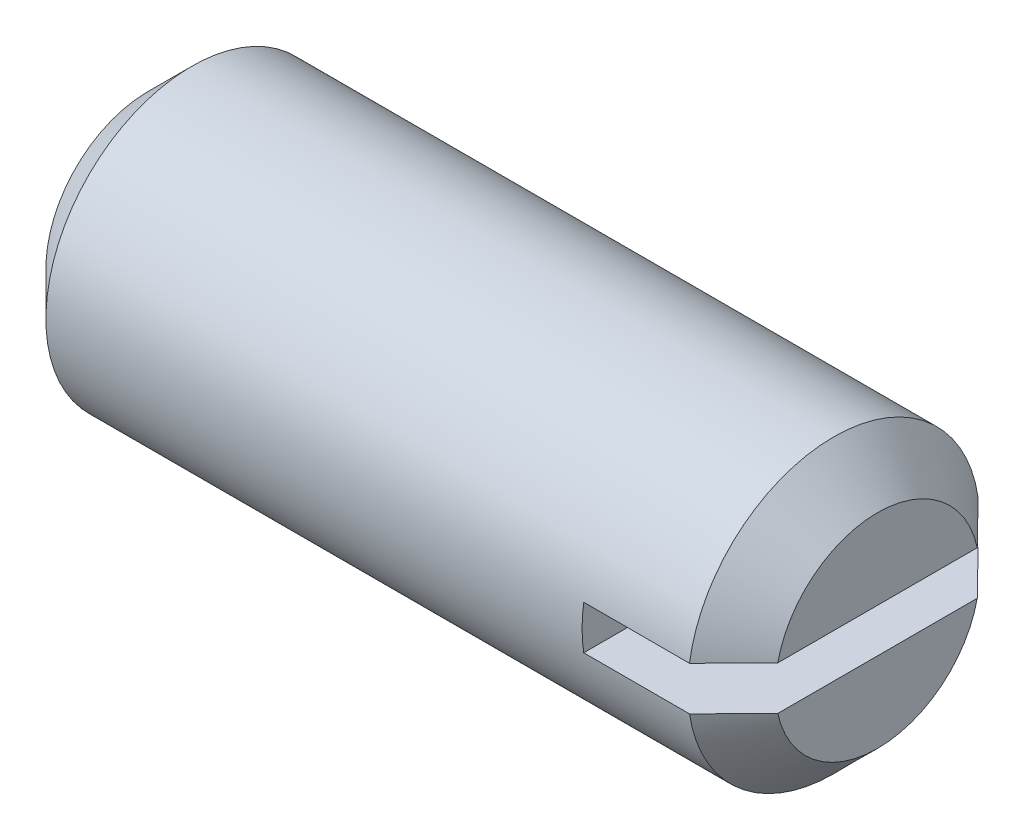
SolidWorks part; units mm, degrees
ref_plane "Front" through (0, 0, 0) normal (0, 0, 1) x (1, 0, 0)
ref_plane "Top" through (0, 0, 0) normal (0, 1, 0) x (1, 0, 0)
ref_plane "Right" through (0, 0, 0) normal (1, 0, 0) x (0, 0, -1)
sketch "Sketch1" plane through (0, 0, 0) normal (1, 0, 0) x (0, 0, -1)
  circle A0 centre (0, 0) radius 2
  dimension "d" = 4
extrude "Body" add sketch "Sketch1" along normal blind 10
chamfer "Chamfer1" distance 0.6 angle 45 2 edges at (10, 0, -2) (0, 0, -2)
sketch "Sketch2" plane through (-1.025, -1.025, 0) normal (0, 0, 1) x (0, 1, 0)
  line L1 (0.725, -8.975) -> (1.325, -8.975)
  line L2 (0.725, -8.975) -> (0.725, -11.025)
  line L3 (0.725, -11.025) -> (1.325, -11.025)
  line L4 (1.325, -8.975) -> (1.325, -11.025)
  line L5 (-0.375, -11.025) -> (2.425, -11.025) construction
  dimension "t" = 2.05
  dimension "n" = 0.6
  dimension "n/2" = 0.3
extrude "Split" cut sketch "Sketch2" against normal through all and the other way through all
sketch "Sketch3" plane through (0, 0, 0) normal (0, 0, 1) x (1, 0, 0)
  line L0 (0, 0) -> (10.1592, 0) construction
  line L1 (4.225, 2.35) -> (4.575, 2.35)
  line L2 (4.575, 2.35) -> (4.575, 2)
  line L3 (4.575, 2) -> (4.4, 1.6969)
  line L4 (4.4, 1.6969) -> (4.225, 2)
  line L5 (4.225, 2) -> (4.225, 2.35)
  line L6 (0, 1.4) -> (0, -1.4) construction
  dimension "D1" = 4
  dimension "D2" = 0.35
  dimension "D3" = 4.4
revolve "Cut-Revolve10" [suppressed] cut sketch "Sketch3" angle 360 about L0
pattern_linear "LPattern10" [suppressed] count 10 spacing 0.42
equation "\"n/2@Sketch2\" = \"n@Sketch2\" / 2"
equation "\"D1@Sketch3\" = \"d@Sketch1\""
equation "\"D2@Sketch3\" =  ( \"d@Sketch1\" - \"D2@ThreadCosmetic1\" )  / 2"
equation "\"D3@Sketch3\" = \"b@ThreadCosmetic1\""
equation "\"D3@LPattern10\" = \"D2@Sketch3\" * 1.2"
equation "\"D1@LPattern10\" = \"b@ThreadCosmetic1\" / \"D3@LPattern10\""
